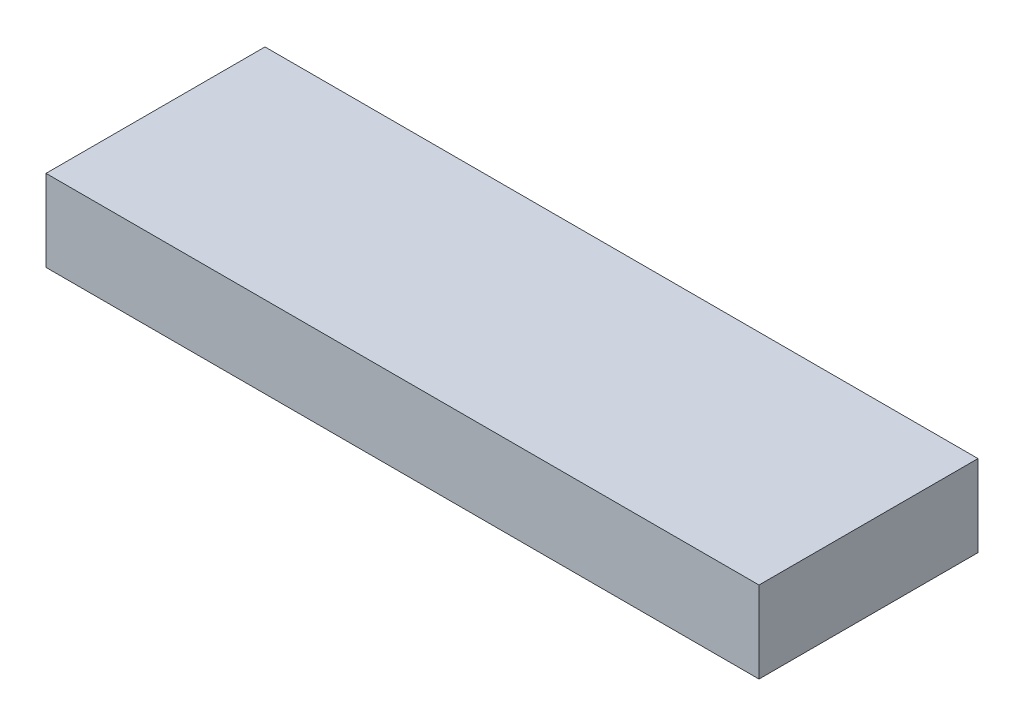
SolidWorks part; units mm, degrees
ref_plane "Front Plane" through (0, 0, 0) normal (0, 0, 1) x (1, 0, 0)
ref_plane "Top Plane" through (0, 0, 0) normal (0, 1, 0) x (1, 0, 0)
ref_plane "Right Plane" through (0, 0, 0) normal (1, 0, 0) x (0, 0, -1)
sketch "Sketch1" plane through (0, 0, 0) normal (0, 1, 0) x (1, 0, 0)
  line L1 (70, -21.5) -> (-70, -21.5)
  line L2 (70, -21.5) -> (70, 21.5)
  line L3 (70, 21.5) -> (-70, 21.5)
  line L4 (-70, -21.5) -> (-70, 21.5)
  line L5 (70, -21.5) -> (-70, 21.5) construction
  line L6 (70, 21.5) -> (-70, -21.5) construction
  point P0 (0, 0)
  dimension "D1" = 140
  dimension "D2" = 43
extrude "Boss-Extrude1" add sketch "Sketch1" along normal mid plane 16
